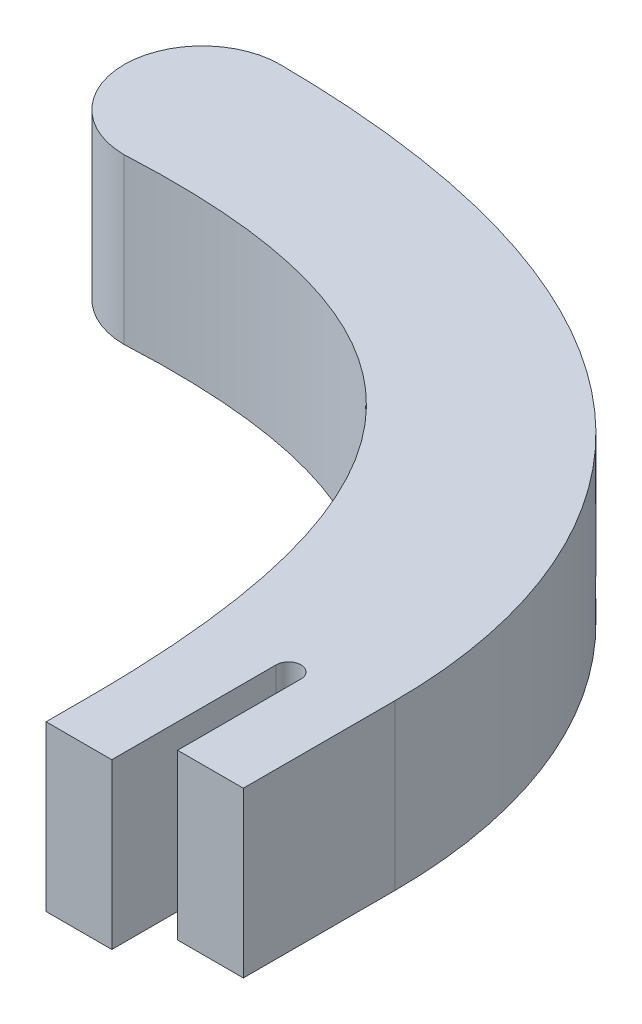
SolidWorks part; units mm, degrees
ref_plane "Спереди (плоскость XY)" through (0, 0, 0) normal (0, 0, 1) x (1, 0, 0)
ref_plane "Сверху(плоскость XZ)" through (0, 0, 0) normal (0, 1, 0) x (1, 0, 0)
ref_plane "Справа(плоскость ZY)" through (0, 0, 0) normal (1, 0, 0) x (0, 0, -1)
sketch "Эскиз1" plane through (0, 0, 0) normal (0, 1, 0) x (1, 0, 0)
  line L0 (0, 39.4743) -> (0, -106.9376) construction
  line L5 (55, -69) -> (55, -74)
  line L6 (55, -74) -> (63, -74)
  line L7 (63, -74) -> (63, -54)
  line L9 (66.0037, -54) -> (66.0037, -68.9993)
  line L10 (66.0037, -68.9993) -> (74.0037, -68.9993)
  line L11 (74.0037, -68.9993) -> (74.0037, -50.5402)
  circle A0 centre (0, 0) radius 8.1
  arc A1 (0, 9.5) -> (0, -9.5) centre (0, 0) ccw
  arc A2 (63, -54) -> (66.0037, -54) centre (64.5019, -54) cw
  spline S1 degree 3 poles (0, -9.5) (39.0098, -7.4881) (55, -25.5274) (55, -69) knots 0 0 0 0 1 1 1 1
  spline S2 degree 3 poles (74.0037, -50.5402) (74.0037, -23.6175) (57.2795, 9.0764) (0, 9.5) knots 0 0 0 0 1 1 1 1
  dimension "D1" = 19
  dimension "D4" = 16.2
  dimension "D10" = 5
  dimension "D11" = 20
  dimension "D5" = 8
  dimension "D6" = 74
  dimension "D7" = 3.0037
  dimension "D8" = 8
  dimension "D9" = 14.9993
extrude "Бобышка-Вытянуть1" add sketch "Эскиз1" along normal blind 20
sketch "Эскиз4" plane through (0, 20, 0) normal (0, 1, 0) x (1, 0, 0)
  circle A0 centre (0, 0) radius 8.1 construction
  circle A1 centre (0, 0) radius 8.1
extrude "Бобышка-Вытянуть3" add sketch "Эскиз4" against normal blind 2
